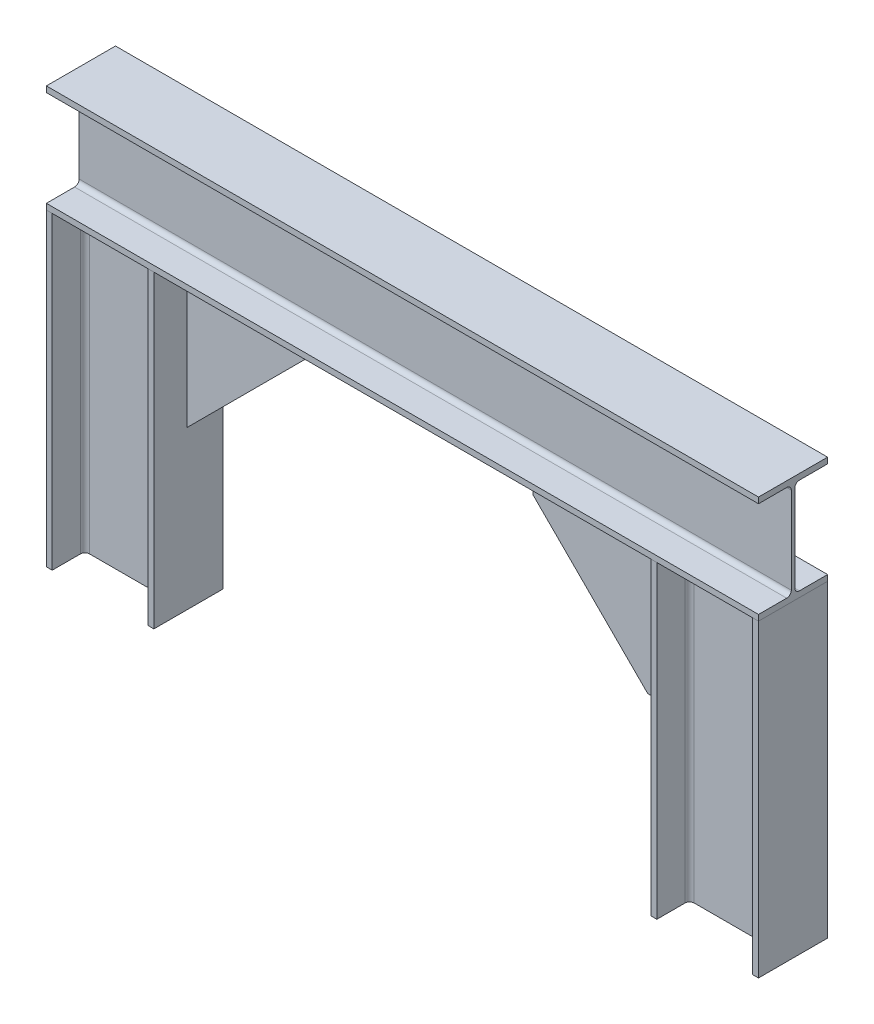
SolidWorks part; units mm, degrees
ref_plane "Front Plane" through (0, 0, 0) normal (0, 0, 1) x (1, 0, 0)
ref_plane "Top Plane" through (0, 0, 0) normal (0, 1, 0) x (1, 0, 0)
ref_plane "Right Plane" through (0, 0, 0) normal (1, 0, 0) x (0, 0, -1)
sketch "Sketch1" plane through (0, 0, 0) normal (0, 0, 1) x (1, 0, 0)
  line L0 (-500, 0) -> (500, 0)
  line L1 (500, 0) -> (500, -600)
  line L2 (-500, 0) -> (-500, -600)
  point P4 (0, 0)
  point P6 (0, 0)
  dimension "D1" = 1000
  dimension "D2" = 600
ref_plane "Plane1" through (-500, 0, 0) normal (1, 0, 0) x (0, 1, 0)
other "Al i beam AL I BEAM 7X5.8(1)"
ref_plane "Plane2" through (-500, 0, 0) normal (0, -1, 0) x (0, 0, 1)
sketch "Sketch110" plane through (-500, 0, 0) normal (0, -1, 0) x (0, 0, 1)
  line L0 (-57.15, -88.9) -> (-57.15, -79.248)
  line L1 (-57.15, -79.248) -> (-10.541, -79.248)
  line L2 (-2.921, -71.628) -> (-2.921, 71.628)
  line L3 (-10.541, 79.248) -> (-57.15, 79.248)
  line L4 (-57.15, 79.248) -> (-57.15, 88.9)
  line L5 (-57.15, 88.9) -> (57.15, 88.9)
  line L6 (57.15, 88.9) -> (57.15, 79.248)
  line L7 (57.15, 79.248) -> (10.541, 79.248)
  line L8 (2.921, 71.628) -> (2.921, -71.628)
  line L9 (10.541, -79.248) -> (57.15, -79.248)
  line L10 (57.15, -79.248) -> (57.15, -88.9)
  line L11 (57.15, -88.9) -> (-57.15, -88.9)
  line L12 (2.921, 0) -> (-2.921, 0) construction
  arc A0 (-10.541, -79.248) -> (-2.921, -71.628) centre (-10.541, -71.628) ccw
  arc A1 (-2.921, 71.628) -> (-10.541, 79.248) centre (-10.541, 71.628) ccw
  arc A2 (10.541, 79.248) -> (2.921, 71.628) centre (10.541, 71.628) ccw
  arc A3 (2.921, -71.628) -> (10.541, -79.248) centre (10.541, -71.628) ccw
  point P20 (0, 88.9)
  point P23 (0.282, 0)
  point P25 (0, -88.9)
  point P26 (0, 0)
  point P27 (0, 0)
  point P28 (0, 0)
  dimension "Ri" = 7.62
  dimension "Tw" = 5.842
  dimension "Bf" = 114.3
  dimension "Depth" = 177.8
  dimension "Tf" = 9.652
other "Al i beam AL I BEAM 7X5.8(3)"
ref_plane "Plane3" through (-500, 0, 0) normal (1, 0, 0) x (0, 0, 1)
sketch "Sketch111" plane through (-500, 0, 0) normal (1, 0, 0) x (0, 0, 1)
  line L0 (-57.15, -88.9) -> (-57.15, -79.248)
  line L1 (-57.15, -79.248) -> (-10.541, -79.248)
  line L2 (-2.921, -71.628) -> (-2.921, 71.628)
  line L3 (-10.541, 79.248) -> (-57.15, 79.248)
  line L4 (-57.15, 79.248) -> (-57.15, 88.9)
  line L5 (-57.15, 88.9) -> (57.15, 88.9)
  line L6 (57.15, 88.9) -> (57.15, 79.248)
  line L7 (57.15, 79.248) -> (10.541, 79.248)
  line L8 (2.921, 71.628) -> (2.921, -71.628)
  line L9 (10.541, -79.248) -> (57.15, -79.248)
  line L10 (57.15, -79.248) -> (57.15, -88.9)
  line L11 (57.15, -88.9) -> (-57.15, -88.9)
  line L12 (2.921, 0) -> (-2.921, 0) construction
  arc A0 (-10.541, -79.248) -> (-2.921, -71.628) centre (-10.541, -71.628) ccw
  arc A1 (-2.921, 71.628) -> (-10.541, 79.248) centre (-10.541, 71.628) ccw
  arc A2 (10.541, 79.248) -> (2.921, 71.628) centre (10.541, 71.628) ccw
  arc A3 (2.921, -71.628) -> (10.541, -79.248) centre (10.541, -71.628) ccw
  point P20 (0, 88.9)
  point P23 (0.282, 0)
  point P25 (0, -88.9)
  point P26 (0, 0)
  dimension "Ri" = 7.62
  dimension "Tw" = 5.842
  dimension "Bf" = 114.3
  dimension "Depth" = 177.8
  dimension "Tf" = 9.652
other "Gusset1" parameters "D1"=5, "D2"=5, "D3"=0, "D4"=0, "D10"=5, "D11"=250, "D12"=250, "D13"=15, "D14"=45, "D15"=15
sketch "Sketch112" plane through (-411.1, -88.9, 0) normal (0, 0, -1) x (-1, 0, 0)
  line L0 (0, 0) -> (-250, 0)
  line L1 (0, 0) -> (0, -250)
  line L2 (-250, 0) -> (0, -250)
other "Gusset2" parameters "D1"=5, "D2"=5, "D3"=0, "D4"=0, "D10"=5, "D11"=250, "D12"=250, "D13"=60, "D14"=45, "D15"=60
sketch "Sketch113" plane through (411.1, -88.9, 0) normal (0, 0, 1) x (1, 0, 0)
  line L0 (0, 0) -> (-250, 0)
  line L1 (0, 0) -> (0, -250)
  line L2 (-250, -60) -> (-60, -250)
  line L3 (-250, 0) -> (-250, -60)
  line L4 (0, -250) -> (-60, -250)
other "Trim/Extend3"
other "Trim/Extend4"
